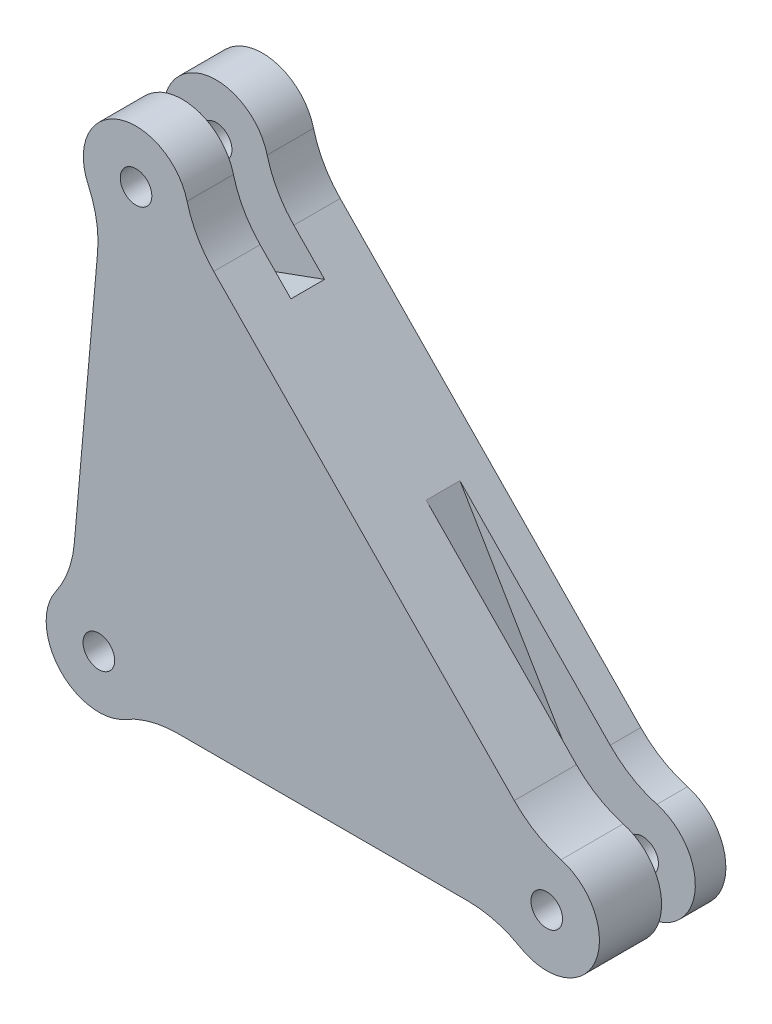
SolidWorks part; units mm, degrees
ref_plane "Plan de face" through (0, 0, 0) normal (0, 0, 1) x (1, 0, 0)
ref_plane "Plan de dessus" through (0, 0, 0) normal (0, 1, 0) x (1, 0, 0)
ref_plane "Plan de droite" through (0, 0, 0) normal (1, 0, 0) x (0, 0, -1)
sketch "Esquisse1" plane through (0, 0, 0) normal (0, 0, 1) x (1, 0, 0)
  line L2 (0, 0) -> (-42.5, 0)
  line L3 (-0.6466, 4.958) -> (-34.0308, 39.1681)
  line L5 (0, 0) -> (-38.9716, 39.9357)
  line L7 (-42.312, 36.2152) -> (-45.1363, 4.2485)
  line L8 (-38.5, -3) -> (-4, -3)
  circle A0 centre (0, 0) radius 1.5
  arc A1 (-4, -3) -> (-0.6466, 4.958) centre (0, 0) ccw
  circle A2 centre (-42.5, 0) radius 1.5
  arc A3 (-45.1363, 4.2485) -> (-38.5, -3) centre (-42.5, 0) ccw
  circle A4 centre (-38.9716, 39.9357) radius 1.5
  arc A5 (-34.0308, 39.1681) -> (-42.312, 36.2152) centre (-38.9716, 39.9357) ccw
  dimension "D1" = 3
  dimension "D2" = 10
  dimension "D4" = 3
  dimension "D5" = 10
  dimension "D8" = 3
  dimension "D9" = 10
  dimension "D3" = 42.5
  dimension "D6" = 47.8
  dimension "D7" = 55.8
  dimension "D10" = 32.0912
  dimension "D11" = 34.5
  dimension "D12" = 45.7
  dimension "D13" = 84.951
  dimension "D14" = 45.7
extrude "Boss.-Extru.1" add sketch "Esquisse1" along normal blind 12
sketch3d "Esquisse3D5" plane through (0, 0, 0) normal (0, 0, 1) x (1, 0, 0)
  dimension "D1" = 6
sketch "Esquisse5" plane through (0, 0, 6) normal (0, 0, 1) x (1, 0, 0)
  line L0 (0, 0) -> (1.3565, 0) construction
  line L1 (0, 0) -> (-38.9716, 39.9357) construction
  line L2 (-38.9716, 39.9357) -> (-38.9716, -7.2836) construction
  line L3 (-38.9716, 39.9357) -> (-38.9716, 29.9357)
  line L4 (-38.9716, 29.9357) -> (-28.6775, 33.6824)
  line L5 (-0.6466, 4.958) -> (-34.0308, 39.1681) construction
  line L6 (-38.9716, 29.9357) -> (-42.9962, 28.4708)
  line L7 (-42.312, 36.2152) -> (-45.1363, 4.2485) construction
  line L8 (-28.6775, 33.6824) -> (-34.0308, 39.1681)
  line L9 (-42.9962, 28.4708) -> (-42.312, 36.2152)
  arc A1 (-34.0308, 39.1681) -> (-42.312, 36.2152) centre (-38.9716, 39.9357) ccw
  circle A2 centre (-38.9716, 39.9357) radius 1.5
  dimension "D2" = 3
  dimension "D1" = 134.3
  dimension "D3" = 90
  dimension "D4" = 10
  dimension "D5" = 70
  dimension "D6" = 110
extrude "Enlèv. mat.-Extru.3" cut sketch "Esquisse5" against normal blind 1.6 and the other way blind 1.6
sketch3d "Esquisse3D6" plane through (0, 0, 0) normal (0, 0, 1) x (1, 0, 0)
  dimension "D1" = 5.9
sketch "Esquisse7" plane through (0, 0, 6.1) normal (0, 0, 1) x (1, 0, 0)
  line L0 (-42.5, 0) -> (-17.3387, 22.0631) construction
  line L1 (-0.6466, 4.958) -> (-34.0308, 39.1681) construction
  line L2 (-29.9194, 11.0315) -> (-43.7241, 20.2319) construction
  line L3 (-42.312, 36.2152) -> (-45.1363, 4.2485) construction
  line L5 (-37.6128, 4.2854) -> (-43.7241, 20.2319)
  line L6 (-37.6128, 4.2854) -> (-21.25, -3)
  line L7 (-38.5, -3) -> (-4, -3) construction
  line L8 (-43.7241, 20.2319) -> (-45.1363, 4.2485)
  line L9 (-38.5, -3) -> (-21.25, -3)
  circle A0 centre (-42.5, 0) radius 1.5
  arc A1 (-45.1363, 4.2485) -> (-38.5, -3) centre (-42.5, 0) ccw
  dimension "D1" = 3
  dimension "D2" = 17.9114
extrude "Enlèv. mat.-Extru.4" cut sketch "Esquisse7" against normal blind 3.2
sketch "Esquisse8" plane through (0, 0, 6.1) normal (0, 0, 1) x (1, 0, 0)
  line L0 (0, 0) -> (-43.7241, 20.2319) construction
  line L1 (-42.312, 36.2152) -> (-45.1363, 4.2485) construction
  line L2 (-4.5378, 2.0997) -> (-5.8991, 2.7296)
  line L3 (-5.8991, 2.7296) -> (-17.3387, 22.0631)
  line L4 (-0.6466, 4.958) -> (-34.0308, 39.1681) construction
  line L5 (-5.8991, 2.7296) -> (-21.25, -3)
  line L6 (-38.5, -3) -> (-4, -3) construction
  line L7 (-17.3387, 22.0631) -> (-0.6466, 4.958)
  line L8 (-21.25, -3) -> (-4, -3)
  circle A0 centre (0, 0) radius 1.5
  arc A1 (-4, -3) -> (-0.6466, 4.958) centre (0, 0) ccw
  dimension "D1" = 3
  dimension "D2" = 16.3853
  dimension "D3" = 1.5
extrude "Enlèv. mat.-Extru.5" cut sketch "Esquisse8" against normal blind 3.2
fillet "Congé1" radius 10 12 edges at (-34.0308, 39.1681, 2.2) (-34.0308, 39.1681, 9.8) (-0.6466, 4.958, 9.05) (-0.6466, 4.958, 1.45) (-4, -3, 1.45) (-4, -3, 9.05) (-38.5, -3, 1.45) (-38.5, -3, 9.05) (-45.1363, 4.2485, 9.05) (-45.1363, 4.2485, 1.45) (-42.312, 36.2152, 2.2) (-42.312, 36.2152, 9.8)
sketch3d "Esquisse3D8" plane through (0, 0, 0) normal (0, 0, 1) x (1, 0, 0)
  dimension "D1" = 2.7
sketch "Esquisse9" plane through (0, 0, 9.3) normal (0, 0, 1) x (1, 0, 0)
  line L0 (-44.8369, 7.6407) -> (-55.0167, 7.6407)
  line L1 (-55.0167, 7.6407) -> (-55.0167, -12.3593)
  line L2 (-55.0167, -12.3593) -> (-35.0167, -12.3593)
  line L3 (-35.0167, -12.3593) -> (-35.0167, -3)
  line L4 (-42.5, 0) -> (-17.8343, 22.5709) construction
  line L5 (-3.0794, 7.451) -> (-31.598, 36.6751) construction
  arc A0 (-46.597, 2.8661) -> (-44.8298, 7.7183) centre (-54.7909, 8.5984) ccw construction
  arc A1 (-35.0167, -3) -> (-44.8369, 7.6407) centre (-35.54, 6.3689) cw
  dimension "D1" = 20
  dimension "D2" = 20
  dimension "D3" = 24
  dimension "D4" = 10.1798
extrude "Enlèv. mat.-Extru.7" cut sketch "Esquisse9" against normal blind 6
chamfer "Chanfrein1" distance 1 angle 45 3 edges at (-37.8587, -3.4123, 9.3) (-46.1878, -3.3764, 9.3)
